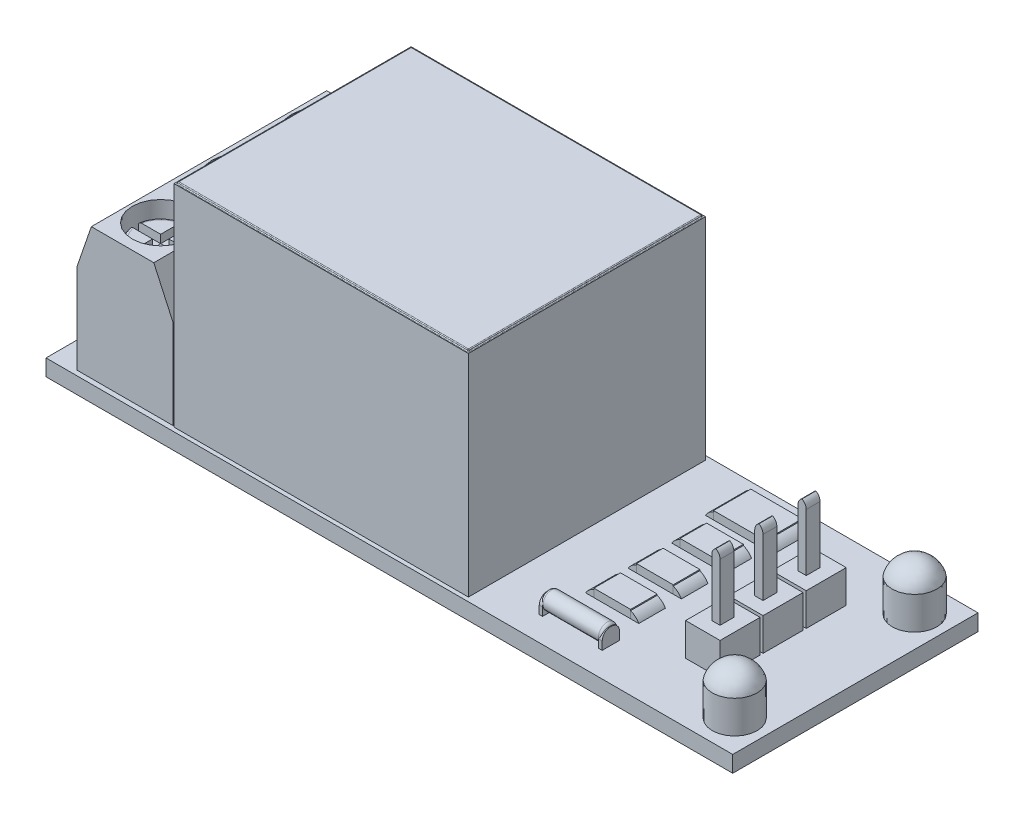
SolidWorks part; units mm, degrees
ref_plane "Front Plane" through (0, 0, 0) normal (0, 0, 1) x (1, 0, 0)
ref_plane "Top Plane" through (0, 0, 0) normal (0, 1, 0) x (1, 0, 0)
ref_plane "Right Plane" through (0, 0, 0) normal (1, 0, 0) x (0, 0, -1)
sketch "Sketch1" plane through (0, 0, 0) normal (0, 1, 0) x (1, 0, 0)
  line L1 (-35.0304, 23.5141) -> (6.9696, 23.5141)
  line L2 (-35.0304, 23.5141) -> (-35.0304, 8.5141)
  line L3 (-35.0304, 8.5141) -> (6.9696, 8.5141)
  line L4 (6.9696, 23.5141) -> (6.9696, 8.5141)
extrude "Boss-Extrude1" add sketch "Sketch1" along normal blind 1
sketch "Sketch2" plane through (0, 1, 0) normal (0, 1, 0) x (1, 0, 0)
  line L1 (-33.4407, 23.2141) -> (-27.5658, 23.2141)
  line L2 (-33.4407, 23.2141) -> (-33.4407, 8.8141)
  line L3 (-33.4407, 8.8141) -> (-27.5658, 8.8141)
  line L4 (-27.5658, 23.2141) -> (-27.5658, 8.8141)
  point P12 (-33.4407, 8.8682)
extrude "Boss-Extrude2" add sketch "Sketch2" along normal blind 8.0398 contours L4 L3 L2 L1
sketch "Sketch4" plane through (0, 0, -8.8141) normal (0, 0, 1) x (1, 0, 0)
  line L0 (-27.5658, 9.0398) -> (-28.7382, 9.0398)
  line L1 (-27.5658, 9.0398) -> (-27.5658, 1) construction
  line L3 (-32.5578, 9.0398) -> (-33.4407, 6.4709)
  line L4 (-33.4407, 9.0398) -> (-33.4407, 1) construction
  line L5 (-33.4407, 9.0398) -> (-32.5578, 9.0398)
  line L6 (-33.4407, 9.0398) -> (-33.4407, 6.4709)
  line L7 (-27.5658, 6.4709) -> (-27.5658, 9.0398)
  line L9 (-28.7382, 9.0398) -> (-27.5658, 6.4709)
  point P1 (-35.8036, 3.2668)
  point P7 (-35.8203, 7.0505)
  dimension "D1" = 1.1724
  dimension "D2" = 0.8829
  dimension "D3" = 2.7163
  dimension "D4" = 2.5688
  dimension "D5" = 2.5688
  dimension "D6" = 2.8237
extrude "Cut-Extrude1" cut sketch "Sketch4" against normal through all
sketch "Sketch5" plane through (-33.4407, 0, 0) normal (-1, 0, 0) x (0, 0, 1)
  line L0 (-9.1325, 6.2944) -> (-9.1325, 1.1765)
  line L1 (-18.1977, 6.2944) -> (-13.8305, 6.2944)
  line L2 (-18.1977, 6.2944) -> (-18.1977, 1.1765)
  line L3 (-18.1977, 1.1765) -> (-13.8305, 1.1765)
  line L4 (-13.8305, 6.2944) -> (-13.8305, 1.1765)
  line L5 (-18.1977, 6.2944) -> (-13.8305, 1.1765) construction
  line L6 (-18.1977, 1.1765) -> (-13.8305, 6.2944) construction
  line L7 (-13.4996, 6.2944) -> (-9.1325, 6.2944)
  line L8 (-13.4996, 6.2944) -> (-13.4996, 1.1765)
  line L9 (-13.4996, 1.1765) -> (-9.1325, 6.2944) construction
  line L10 (-13.4996, 6.2944) -> (-9.1325, 1.1765) construction
  line L11 (-13.4996, 1.1765) -> (-9.1325, 1.1765)
  line L13 (-22.8948, 6.2944) -> (-22.8948, 1.1765)
  line L14 (-18.5277, 6.2944) -> (-18.5277, 1.1765)
  line L15 (-22.8948, 1.1765) -> (-18.5277, 1.1765)
  line L16 (-22.8948, 6.2944) -> (-18.5277, 1.1765) construction
  line L17 (-22.8948, 1.1765) -> (-18.5277, 6.2944) construction
  line L18 (-22.8948, 6.2944) -> (-18.5277, 6.2944)
  point P0 (-16.0141, 3.7355)
  point P5 (-11.316, 3.7355)
  point P10 (-20.7113, 3.7355)
extrude "Cut-Extrude2" cut sketch "Sketch5" against normal blind 7
ref_plane "Plane1" through (0, 9.0398, 0) normal (0, 1, 0) x (1, 0, 0)
sketch "Sketch8" plane through (0, 9.0398, 0) normal (0, 1, 0) x (1, 0, 0)
  circle A0 centre (-30.648, 16.0141) radius 1.7383
  circle A1 centre (-30.648, 20.8864) radius 1.7383
  circle A2 centre (-30.648, 11.1441) radius 1.7383
extrude "Cut-Extrude3" cut sketch "Sketch8" against normal up to next
ref_plane "Plane2" through (0, 1.1765, 0) normal (0, 1, 0) x (1, 0, 0)
sketch "Sketch10" plane through (0, 1.1765, 0) normal (0, 1, 0) x (1, 0, 0)
  line L0 (-32.9407, 18.1977) -> (-32.9407, 13.8305)
  line L1 (-28.0658, 18.5277) -> (-28.0658, 22.8948)
  line L2 (-28.0658, 13.8305) -> (-28.0658, 18.1977)
  line L3 (-32.9407, 13.4996) -> (-32.9407, 9.1325)
  line L4 (-32.9407, 9.1325) -> (-28.0658, 9.1325)
  line L8 (-27.5658, 9.1325) -> (-27.5658, 13.4996)
  line L9 (-27.5658, 13.4996) -> (-33.4407, 13.4996)
  line L10 (-33.4407, 13.4996) -> (-33.4407, 9.1325)
  line L11 (-33.4407, 9.1325) -> (-27.5658, 9.1325)
  line L13 (-28.0658, 13.4996) -> (-32.9407, 13.4996)
  line L20 (-27.5658, 13.8305) -> (-27.5658, 18.1977)
  line L21 (-27.5658, 18.1977) -> (-33.4407, 18.1977)
  line L22 (-33.4407, 18.1977) -> (-33.4407, 13.8305)
  line L23 (-33.4407, 13.8305) -> (-27.5658, 13.8305)
  line L25 (-27.5658, 18.1977) -> (-32.9407, 18.1977)
  line L27 (-32.9407, 13.8305) -> (-28.0658, 13.8305)
  line L30 (-28.0658, 9.1325) -> (-28.0658, 13.4996)
  line L32 (-27.5658, 18.5277) -> (-27.5658, 22.8948)
  line L33 (-27.5658, 22.8948) -> (-33.4407, 22.8948)
  line L34 (-33.4407, 22.8948) -> (-33.4407, 18.5277)
  line L35 (-33.4407, 18.5277) -> (-27.5658, 18.5277)
  line L37 (-28.0658, 22.8948) -> (-32.9407, 22.8948)
  line L39 (-32.9407, 18.5277) -> (-28.0658, 18.5277)
  line L40 (-32.9407, 22.8948) -> (-32.9407, 18.5277)
  dimension "D4" = 4.8749
  dimension "D5" = 0.5
  dimension "D6" = 13.7624
  dimension "D7" = 0.5
  dimension "D8" = 13.7624
  dimension "D1" = 0
  dimension "D2" = 0
  dimension "D3" = 0
extrude "Boss-Extrude3" add sketch "Sketch10" along normal blind 5 contours L4 L30 L13 L3 | L0 L27 L2 L25 | L37 L40 L39 L1
ref_plane "Plane4" through (-32.9407, 0, 0) normal (-1, 0, 0) x (0, 0, 1)
sketch "Sketch11" plane through (-32.9407, 0, 0) normal (-1, 0, 0) x (0, 0, 1)
  line L8 (-13.2996, 1.3765) -> (-9.3325, 1.3765)
  line L9 (-9.3325, 1.3765) -> (-9.3325, 5.9765)
  line L10 (-9.3325, 5.9765) -> (-13.2996, 5.9765)
  line L11 (-13.2996, 5.9765) -> (-13.2996, 1.3765)
  line L12 (-13.2996, 1.3765) -> (-9.3325, 1.3765)
  line L13 (-9.3325, 1.3765) -> (-9.3325, 5.9765)
  line L14 (-9.3325, 5.9765) -> (-13.2996, 5.9765)
  line L15 (-13.2996, 5.9765) -> (-13.2996, 1.3765)
  line L20 (-17.9977, 1.3765) -> (-14.0305, 1.3765)
  line L21 (-14.0305, 1.3765) -> (-14.0305, 5.9765)
  line L22 (-14.0305, 5.9765) -> (-17.9977, 5.9765)
  line L23 (-17.9977, 5.9765) -> (-17.9977, 1.3765)
  line L24 (-17.9977, 1.3765) -> (-14.0305, 1.3765)
  line L25 (-14.0305, 1.3765) -> (-14.0305, 5.9765)
  line L26 (-14.0305, 5.9765) -> (-17.9977, 5.9765)
  line L27 (-17.9977, 5.9765) -> (-17.9977, 1.3765)
  line L32 (-22.6948, 1.3765) -> (-18.7277, 1.3765)
  line L33 (-18.7277, 1.3765) -> (-18.7277, 5.9765)
  line L34 (-18.7277, 5.9765) -> (-22.6948, 5.9765)
  line L35 (-22.6948, 5.9765) -> (-22.6948, 1.3765)
  line L36 (-22.6948, 1.3765) -> (-18.7277, 1.3765)
  line L37 (-18.7277, 1.3765) -> (-18.7277, 5.9765)
  line L38 (-18.7277, 5.9765) -> (-22.6948, 5.9765)
  line L39 (-22.6948, 5.9765) -> (-22.6948, 1.3765)
  dimension "D1" = 0.2
  dimension "D2" = 0.2
  dimension "D3" = 0.2
extrude "Cut-Extrude4" cut sketch "Sketch11" against normal up to next
ref_plane "Plane5" through (0, 5.9765, 0) normal (0, -1, 0) x (-1, 0, 0)
sketch "Sketch12" plane through (0, 5.9765, 0) normal (0, -1, 0) x (-1, 0, 0)
  line L0 (32.9407, 18.7277) -> (32.7407, 18.7277)
  line L1 (32.9407, 9.3325) -> (32.7407, 9.3325)
  line L2 (32.9407, 9.3325) -> (32.9407, 13.2996)
  line L3 (32.9407, 22.6948) -> (32.7407, 22.6948)
  line L4 (32.7407, 9.3325) -> (32.7407, 13.2996)
  line L5 (28.0658, 18.7277) -> (32.9407, 18.7277) construction
  line L6 (32.9407, 17.9977) -> (32.7407, 17.9977)
  line L7 (28.0658, 17.9977) -> (32.9407, 17.9977) construction
  line L8 (32.7407, 18.7277) -> (32.7407, 22.6948)
  line L9 (32.9407, 18.7277) -> (32.9407, 22.6948)
  line L10 (32.9407, 14.0305) -> (32.7407, 14.0305)
  line L11 (28.0658, 14.0305) -> (32.9407, 14.0305) construction
  line L12 (32.9407, 13.2996) -> (32.7407, 13.2996)
  line L13 (28.0658, 13.2996) -> (32.9407, 13.2996) construction
  line L14 (32.7407, 14.0305) -> (32.7407, 17.9977)
  line L15 (32.9407, 14.0305) -> (32.9407, 17.9977)
  point P18 (0, 0)
  point P24 (32.3911, 17.1391)
  point P25 (31.8955, 17.4051)
  point P26 (31.9424, 17.3915)
  point P27 (36.0712, 23.2788)
  dimension "D1" = 0.2
  dimension "D2" = 0.2
  dimension "D3" = 0.2
  dimension "D4" = 0.2
extrude "Boss-Extrude6" add sketch "Sketch12" along normal blind 2.5 draft 2
ref_plane "Plane7" through (0, 6.1765, 0) normal (0, 1, 0) x (1, 0, 0)
sketch "Sketch18" plane through (0, 6.1765, 0) normal (0, 1, 0) x (1, 0, 0)
  circle A2 centre (-30.648, 20.8864) radius 1.6383
  circle A3 centre (-30.648, 20.8864) radius 1.6383
  circle A5 centre (-30.648, 16.0141) radius 1.6383
  circle A6 centre (-30.648, 16.0141) radius 1.6383
  circle A8 centre (-30.648, 11.1441) radius 1.6383
  circle A9 centre (-30.648, 11.1441) radius 1.6383
  dimension "D1" = 0.1
  dimension "D2" = 0.1
  dimension "D3" = 0.1
extrude "Boss-Extrude7" add sketch "Sketch18" along normal blind 2
sketch "Sketch19" plane through (0, 8.1765, 0) normal (0, 1, 0) x (1, 0, 0)
  line L0 (-32.313, 15.7641) -> (-30.898, 15.7641)
  line L1 (-30.398, 17.6841) -> (-30.398, 16.2641)
  line L2 (-30.898, 22.5561) -> (-30.898, 21.1364)
  line L3 (-28.9847, 21.1364) -> (-28.9847, 20.6364)
  line L4 (-30.398, 22.5561) -> (-30.398, 21.1364)
  line L5 (-32.313, 21.1364) -> (-32.313, 20.6364)
  line L6 (-32.313, 16.2641) -> (-32.313, 15.7641)
  line L7 (-32.313, 21.1364) -> (-30.898, 21.1364)
  line L9 (-32.313, 20.6364) -> (-30.898, 20.6364)
  line L11 (-28.9998, 16.2641) -> (-28.9998, 15.7641)
  line L12 (-28.9998, 11.3941) -> (-28.9998, 10.8941)
  line L13 (-32.313, 16.2641) -> (-30.898, 16.2641)
  line L15 (-32.313, 11.3941) -> (-32.313, 10.8941)
  line L18 (-32.313, 10.8941) -> (-30.898, 10.8941)
  line L19 (-32.313, 11.3941) -> (-30.898, 11.3941)
  line L24 (-30.398, 10.8941) -> (-30.398, 9.4899)
  line L25 (-30.898, 10.8941) -> (-30.898, 9.4899)
  line L26 (-30.398, 11.3941) -> (-28.9998, 11.3941)
  line L27 (-30.398, 10.8941) -> (-28.9998, 10.8941)
  line L28 (-30.398, 15.7641) -> (-30.398, 14.3643)
  line L29 (-30.398, 15.7641) -> (-28.9998, 15.7641)
  line L30 (-30.898, 15.7641) -> (-30.898, 14.3643)
  line L31 (-30.398, 16.2641) -> (-28.9998, 16.2641)
  line L32 (-30.398, 20.6364) -> (-28.9847, 20.6364)
  line L33 (-30.898, 20.6364) -> (-30.898, 19.224)
  line L34 (-30.398, 20.6364) -> (-30.398, 19.224)
  line L35 (-30.398, 21.1364) -> (-28.9847, 21.1364)
  line L36 (-30.898, 12.8093) -> (-30.398, 12.8093)
  line L37 (-30.898, 9.4899) -> (-30.398, 9.4899)
  line L38 (-30.898, 14.3643) -> (-30.398, 14.3643)
  line L39 (-30.898, 17.6841) -> (-30.398, 17.6841)
  line L40 (-30.898, 19.224) -> (-30.398, 19.224)
  line L41 (-30.898, 22.5561) -> (-30.398, 22.5561)
  line L42 (-30.898, 17.6841) -> (-30.898, 16.2641)
  line L43 (-30.398, 12.8093) -> (-30.398, 11.3941)
  line L44 (-30.898, 12.8093) -> (-30.898, 11.3941)
  point P0 (-30.648, 16.0141)
  point P5 (-30.648, 20.8864)
  point P14 (-30.648, 16.0141)
  point P19 (-30.648, 11.1441)
  point P56 (-34.0838, 11.31)
  dimension "D2" = 0.5
  dimension "D3" = 0.5
  dimension "D4" = 0.5
  dimension "D5" = 0.5
  dimension "D6" = 0.5
  dimension "D7" = 0.5
  dimension "D8" = 0.5
  dimension "D9" = 0.5
  dimension "D10" = 0.5
  dimension "D11" = 0.5
  dimension "D12" = 0.5
  dimension "D13" = 0.5
fillet "Fillet1" radius 0.2 3 edges at (-30.648, 8.1765, -9.5058) (-30.648, 8.1765, -19.2481) (-30.648, 8.1765, -14.3758)
extrude "Cut-Extrude6" cut sketch "Sketch19" against normal blind 0.5
ref_plane "Plane8" through (0, 1, 0) normal (0, 1, 0) x (1, 0, 0)
sketch "Sketch20" plane through (0, 1, 0) normal (0, 1, 0) x (1, 0, 0)
  line L1 (-27.4469, 23.2641) -> (-9.4469, 23.2641)
  line L2 (-27.4469, 23.2641) -> (-27.4469, 8.7641)
  line L3 (-27.4469, 8.7641) -> (-9.4469, 8.7641)
  line L4 (-9.4469, 23.2641) -> (-9.4469, 8.7641)
  line L5 (-27.4469, 23.2641) -> (-9.4469, 8.7641) construction
  line L6 (-27.4469, 8.7641) -> (-9.4469, 23.2641) construction
  point P0 (-14.0304, 16.0141)
  point P1 (-18.4469, 16.0141)
extrude "Boss-Extrude8" add sketch "Sketch20" along normal blind 13
sketch "Sketch22" plane through (0, 14, 0) normal (0, 1, 0) x (1, 0, 0)
  line L8 (-9.5469, 8.8641) -> (-9.5469, 23.1641)
  line L9 (-9.5469, 23.1641) -> (-27.3469, 23.1641)
  line L10 (-27.3469, 23.1641) -> (-27.3469, 8.8641)
  line L11 (-27.3469, 8.8641) -> (-9.5469, 8.8641)
  line L12 (-9.5469, 8.8641) -> (-9.5469, 23.1641)
  line L13 (-9.5469, 23.1641) -> (-27.3469, 23.1641)
  line L14 (-27.3469, 23.1641) -> (-27.3469, 8.8641)
  line L15 (-27.3469, 8.8641) -> (-9.5469, 8.8641)
  dimension "D1" = 0.1
extrude "Cut-Extrude9" cut sketch "Sketch22" against normal blind 0.1 flip side to cut
fillet "Fillet2" radius 0.05 7 edges at (-18.4469, 13.9, -23.1641) (-18.4469, 13.9, -8.8641) (-9.5469, 13.9, -16.0141) (-9.5469, 14, -16.0141) (-18.4469, 14, -23.1641) (-27.3469, 14, -16.0141) (-18.4469, 14, -8.8641)
ref_plane "Plane9" through (0, 1, 0) normal (0, 1, 0) x (1, 0, 0)
sketch "Sketch24" plane through (0, 1, 0) normal (0, 1, 0) x (1, 0, 0)
  line L0 (5.0911, 10.5141) -> (5.0911, 11.885) construction
  circle A0 centre (5.0911, 10.5141) radius 1.3709
  circle A1 centre (5.0911, 21.5141) radius 1.3709
  dimension "D1" = 1.3709
ref_plane "Plane10" through (5.0911, 0, 0) normal (1, 0, 0) x (0, 0, -1)
sketch "Sketch25" plane through (5.0911, 0, 0) normal (1, 0, 0) x (0, 0, -1)
  line L0 (10.5141, 1) -> (11.885, 1)
  line L1 (10.5141, 1) -> (10.5141, 4)
  line L2 (11.885, 3) -> (11.885, 1)
  arc A0 (10.5141, 4) -> (11.885, 3) centre (10.565, 2.63) cw
  dimension "D2" = 3
  dimension "D3" = 1.3709
  dimension "D1" = 1.3709
  dimension "D4" = 2
revolve "Revolve1" add sketch "Sketch25" angle 360 about L1
sketch "Sketch26" plane through (5.0911, 0, 0) normal (1, 0, 0) x (0, 0, -1)
  line L3 (22.885, 3) -> (22.885, 1)
  line L4 (21.5141, 1) -> (22.885, 1)
  line L5 (21.5141, 1) -> (21.5141, 4)
  arc A1 (21.5141, 4) -> (22.885, 3) centre (21.565, 2.63) cw
revolve "Revolve2" add sketch "Sketch26" angle 360 about L5
sketch "Sketch27" plane through (0, 1, 0) normal (0, 1, 0) x (1, 0, 0)
  line L0 (0.438, 19.8786) -> (0.438, 17.433)
  line L1 (0.438, 17.2369) -> (2.5459, 17.2369)
  line L2 (0.438, 17.2369) -> (0.438, 14.7913)
  line L3 (0.438, 14.7913) -> (2.5459, 14.7913)
  line L4 (2.5459, 17.2369) -> (2.5459, 14.7913)
  line L5 (0.438, 17.2369) -> (2.5459, 14.7913) construction
  line L6 (0.438, 14.7913) -> (2.5459, 17.2369) construction
  line L7 (0.438, 17.433) -> (2.5459, 19.8786) construction
  line L8 (0.438, 19.8786) -> (2.5459, 19.8786)
  line L9 (0.438, 17.433) -> (2.5459, 17.433)
  line L10 (0.438, 19.8786) -> (2.5459, 17.433) construction
  line L11 (2.5459, 19.8786) -> (2.5459, 17.433)
  line L12 (0.438, 14.6088) -> (0.438, 12.1632)
  line L13 (0.438, 12.1632) -> (2.5459, 14.6088) construction
  line L14 (0.438, 14.6088) -> (2.5459, 14.6088)
  line L15 (0.438, 12.1632) -> (2.5459, 12.1632)
  line L16 (0.438, 14.6088) -> (2.5459, 12.1632) construction
  line L17 (2.5459, 14.6088) -> (2.5459, 12.1632)
  point P0 (1.492, 16.0141)
  point P5 (1.492, 18.6558)
  point P10 (1.492, 13.386)
extrude "Boss-Extrude9" add sketch "Sketch27" along normal blind 2
ref_plane "Plane11" through (0, 3, 0) normal (0, 1, 0) x (1, 0, 0)
sketch "Sketch28" plane through (0, 3, 0) normal (0, 1, 0) x (1, 0, 0)
  line L8 (1.7459, 18.233) -> (1.7459, 19.0786)
  line L9 (1.7459, 19.0786) -> (1.238, 19.0786)
  line L10 (1.238, 19.0786) -> (1.238, 18.233)
  line L11 (1.238, 18.233) -> (1.7459, 18.233)
  line L12 (1.7459, 18.233) -> (1.7459, 19.0786)
  line L13 (1.7459, 19.0786) -> (1.238, 19.0786)
  line L14 (1.238, 19.0786) -> (1.238, 18.233)
  line L15 (1.238, 18.233) -> (1.7459, 18.233)
  line L20 (1.7459, 15.5913) -> (1.7459, 16.4369)
  line L21 (1.7459, 16.4369) -> (1.238, 16.4369)
  line L22 (1.238, 16.4369) -> (1.238, 15.5913)
  line L23 (1.238, 15.5913) -> (1.7459, 15.5913)
  line L24 (1.7459, 15.5913) -> (1.7459, 16.4369)
  line L25 (1.7459, 16.4369) -> (1.238, 16.4369)
  line L26 (1.238, 16.4369) -> (1.238, 15.5913)
  line L27 (1.238, 15.5913) -> (1.7459, 15.5913)
  line L32 (1.7459, 12.9632) -> (1.7459, 13.8088)
  line L33 (1.7459, 13.8088) -> (1.238, 13.8088)
  line L34 (1.238, 13.8088) -> (1.238, 12.9632)
  line L35 (1.238, 12.9632) -> (1.7459, 12.9632)
  line L36 (1.7459, 12.9632) -> (1.7459, 13.8088)
  line L37 (1.7459, 13.8088) -> (1.238, 13.8088)
  line L38 (1.238, 13.8088) -> (1.238, 12.9632)
  line L39 (1.238, 12.9632) -> (1.7459, 12.9632)
  dimension "D1" = 0.8
  dimension "D2" = 0.8
  dimension "D3" = 0.8
extrude "Boss-Extrude11" add sketch "Sketch28" along normal blind 4
fillet "Fillet3" radius 0.5 6 edges at (1.238, 7, -18.6558) (1.7459, 7, -18.6558) (1.7459, 7, -16.0141) (1.238, 7, -16.0141) (1.238, 7, -13.386) (1.7459, 7, -13.386)
sketch "Sketch31" plane through (0, 1, 0) normal (0, 1, 0) x (1, 0, 0)
  line L0 (-5.5816, 19.4688) -> (-3.3351, 17.8428) construction
  line L1 (-5.5816, 16.8055) -> (-3.3351, 16.8055)
  line L2 (-5.5816, 16.8055) -> (-5.5816, 15.1795)
  line L3 (-5.5816, 15.1795) -> (-3.3351, 15.1795)
  line L4 (-3.3351, 16.8055) -> (-3.3351, 15.1795)
  line L5 (-5.5816, 16.8055) -> (-3.3351, 15.1795) construction
  line L6 (-5.5816, 15.1795) -> (-3.3351, 16.8055) construction
  line L7 (-5.5816, 19.4688) -> (-3.3351, 19.4688)
  line L8 (-5.5816, 17.8428) -> (-3.3351, 19.4688) construction
  line L9 (-5.5816, 17.8428) -> (-3.3351, 17.8428)
  line L10 (-5.5816, 19.4688) -> (-5.5816, 17.8428)
  line L11 (-3.3351, 19.4688) -> (-3.3351, 17.8428)
  line L12 (-5.5816, 14.199) -> (-3.3351, 12.573) construction
  line L13 (-5.5816, 14.199) -> (-3.3351, 14.199)
  line L14 (-5.5816, 12.573) -> (-3.3351, 14.199) construction
  line L15 (-5.5816, 12.573) -> (-3.3351, 12.573)
  line L16 (-5.5816, 14.199) -> (-5.5816, 12.573)
  line L17 (-3.3351, 14.199) -> (-3.3351, 12.573)
  line L18 (-6.0309, 22.6192) -> (-2.8858, 20.3428) construction
  line L19 (-6.0309, 22.6192) -> (-2.8858, 22.6192)
  line L20 (-6.0309, 20.3428) -> (-2.8858, 22.6192) construction
  line L21 (-6.0309, 20.3428) -> (-2.8858, 20.3428)
  line L22 (-6.0309, 22.6192) -> (-6.0309, 20.3428)
  line L23 (-2.8858, 22.6192) -> (-2.8858, 20.3428)
  point P0 (-4.4583, 15.9925)
  point P5 (-4.4583, 18.6558)
  point P10 (-4.4583, 13.386)
  point P15 (-4.4583, 21.481)
extrude "Boss-Extrude12" add sketch "Sketch31" along normal blind 0.5
sketch "Sketch33" plane through (-3.3351, 0, 0) normal (1, 0, 0) x (0, 0, -1)
  line L8 (12.573, 1) -> (14.199, 1)
  line L9 (14.199, 1) -> (14.199, 1.5)
  line L10 (14.199, 1.5) -> (12.573, 1.5)
  line L11 (12.573, 1.5) -> (12.573, 1)
  line L12 (12.573, 1) -> (14.199, 1)
  line L13 (14.199, 1) -> (14.199, 1.5)
  line L14 (14.199, 1.5) -> (12.573, 1.5)
  line L15 (12.573, 1.5) -> (12.573, 1)
  line L20 (15.1795, 1) -> (16.8055, 1)
  line L21 (16.8055, 1) -> (16.8055, 1.5)
  line L22 (16.8055, 1.5) -> (15.1795, 1.5)
  line L23 (15.1795, 1.5) -> (15.1795, 1)
  line L24 (15.1795, 1) -> (16.8055, 1)
  line L25 (16.8055, 1) -> (16.8055, 1.5)
  line L26 (16.8055, 1.5) -> (15.1795, 1.5)
  line L27 (15.1795, 1.5) -> (15.1795, 1)
  line L32 (17.8428, 1) -> (19.4688, 1)
  line L33 (19.4688, 1) -> (19.4688, 1.5)
  line L34 (19.4688, 1.5) -> (17.8428, 1.5)
  line L35 (17.8428, 1.5) -> (17.8428, 1)
  line L36 (17.8428, 1) -> (19.4688, 1)
  line L37 (19.4688, 1) -> (19.4688, 1.5)
  line L38 (19.4688, 1.5) -> (17.8428, 1.5)
  line L39 (17.8428, 1.5) -> (17.8428, 1)
  dimension "D1" = 0
  dimension "D2" = 0
  dimension "D3" = 0
extrude "Boss-Extrude13" add sketch "Sketch33" along normal blind 0.5 separate body
fillet "Fillet5" radius 1 1 edges at (-2.8351, 1.5, -13.386)
fillet "Fillet6" radius 1 1 edges at (-2.8351, 1.5, -15.9925)
fillet "Fillet7" radius 1 1 edges at (-2.8351, 1.5, -18.6558)
sketch "Sketch34" plane through (-2.8858, 0, 0) normal (1, 0, 0) x (0, 0, -1)
  line L8 (20.3428, 1) -> (22.6192, 1)
  line L9 (22.6192, 1) -> (22.6192, 1.5)
  line L10 (22.6192, 1.5) -> (20.3428, 1.5)
  line L11 (20.3428, 1.5) -> (20.3428, 1)
  line L12 (20.3428, 1) -> (22.6192, 1)
  line L13 (22.6192, 1) -> (22.6192, 1.5)
  line L14 (22.6192, 1.5) -> (20.3428, 1.5)
  line L15 (20.3428, 1.5) -> (20.3428, 1)
  dimension "D1" = 0
extrude "Boss-Extrude14" add sketch "Sketch34" along normal blind 0.5 separate body
fillet "Fillet9" radius 1 1 edges at (-2.3858, 1.5, -21.481)
sketch "Sketch35" plane through (-5.5816, 0, 0) normal (-1, 0, 0) x (0, 0, 1)
  line L8 (-14.199, 1) -> (-12.573, 1)
  line L9 (-12.573, 1) -> (-12.573, 1.5)
  line L10 (-12.573, 1.5) -> (-14.199, 1.5)
  line L11 (-14.199, 1.5) -> (-14.199, 1)
  line L12 (-14.199, 1) -> (-12.573, 1)
  line L13 (-12.573, 1) -> (-12.573, 1.5)
  line L14 (-12.573, 1.5) -> (-14.199, 1.5)
  line L15 (-14.199, 1.5) -> (-14.199, 1)
  line L20 (-16.8055, 1) -> (-15.1795, 1)
  line L21 (-15.1795, 1) -> (-15.1795, 1.5)
  line L22 (-15.1795, 1.5) -> (-16.8055, 1.5)
  line L23 (-16.8055, 1.5) -> (-16.8055, 1)
  line L24 (-16.8055, 1) -> (-15.1795, 1)
  line L25 (-15.1795, 1) -> (-15.1795, 1.5)
  line L26 (-15.1795, 1.5) -> (-16.8055, 1.5)
  line L27 (-16.8055, 1.5) -> (-16.8055, 1)
  line L32 (-19.4688, 1) -> (-17.8428, 1)
  line L33 (-17.8428, 1) -> (-17.8428, 1.5)
  line L34 (-17.8428, 1.5) -> (-19.4688, 1.5)
  line L35 (-19.4688, 1.5) -> (-19.4688, 1)
  line L36 (-19.4688, 1) -> (-17.8428, 1)
  line L37 (-17.8428, 1) -> (-17.8428, 1.5)
  line L38 (-17.8428, 1.5) -> (-19.4688, 1.5)
  line L39 (-19.4688, 1.5) -> (-19.4688, 1)
  dimension "D1" = 0
  dimension "D2" = 0
  dimension "D3" = 0
extrude "Boss-Extrude15" add sketch "Sketch35" along normal blind 0.5 separate body
fillet "Fillet10" radius 1 1 edges at (-6.0816, 1.5, -13.386)
fillet "Fillet11" radius 1 1 edges at (-6.0816, 1.5, -15.9925)
fillet "Fillet12" radius 1 1 edges at (-6.0816, 1.5, -18.6558)
sketch "Sketch36" plane through (-6.0309, 0, 0) normal (-1, 0, 0) x (0, 0, 1)
  line L8 (-22.6192, 1) -> (-20.3428, 1)
  line L9 (-20.3428, 1) -> (-20.3428, 1.5)
  line L10 (-20.3428, 1.5) -> (-22.6192, 1.5)
  line L11 (-22.6192, 1.5) -> (-22.6192, 1)
  line L12 (-22.6192, 1) -> (-20.3428, 1)
  line L13 (-20.3428, 1) -> (-20.3428, 1.5)
  line L14 (-20.3428, 1.5) -> (-22.6192, 1.5)
  line L15 (-22.6192, 1.5) -> (-22.6192, 1)
  dimension "D1" = 0
extrude "Boss-Extrude16" add sketch "Sketch36" along normal blind 0.5 separate body
fillet "Fillet13" radius 1 1 edges at (-6.5309, 1.5, -21.481)
sketch "Sketch37" plane through (0, 1, 0) normal (0, 1, 0) x (1, 0, 0)
  line L0 (-6.3544, 9.4485) -> (-6.3544, 10.5609) construction
  line L1 (-6.3544, 10.5609) -> (-2.1524, 10.5609) construction
  dimension "D1" = 1.1124
  dimension "D2" = 4.202
ref_plane "Plane12" through (-6.3544, 0, 0) normal (1, 0, 0) x (0, 0, -1)
sketch "Sketch38" plane through (-6.3544, 0, 0) normal (1, 0, 0) x (0, 0, -1)
  line L0 (10.5609, 1) -> (10.5609, 1.6) construction
  circle A0 centre (10.5609, 1.6) radius 0.5289
  dimension "D1" = 0.6
extrude "Boss-Extrude17" add sketch "Sketch38" along normal blind 3.8 separate body
fillet "Fillet14" radius 0.2 2 edges at (-6.3544, 1.6, -11.0898) (-2.5544, 1.6, -11.0898)
sketch "Sketch41" plane through (0, 1, 0) normal (0, 1, 0) x (1, 0, 0)
  line L0 (-6.3544, 9.4485) -> (-6.3544, 10.5609) construction
  line L1 (-2.7544, 11.0898) -> (-2.5322, 11.0898)
  line L2 (-2.7544, 11.0898) -> (-2.7544, 10.0316)
  line L3 (-2.7544, 10.0316) -> (-2.5322, 10.0316)
  line L4 (-2.5322, 11.0898) -> (-2.5322, 10.0316)
  line L5 (-6.1544, 11.0898) -> (-6.3544, 11.0898)
  line L6 (-6.1544, 11.0898) -> (-6.1544, 10.0047)
  line L7 (-6.1544, 10.0047) -> (-6.3544, 10.0047)
  line L8 (-6.3544, 11.0898) -> (-6.3544, 10.0047)
extrude "Boss-Extrude18" add sketch "Sketch41" along normal blind 1
fillet "Fillet15" radius 0.5 4 edges at (-6.2544, 2, -10.0047) (-6.2544, 2, -11.0898) (-2.6433, 2, -11.0898) (-2.6433, 2, -10.0316)
